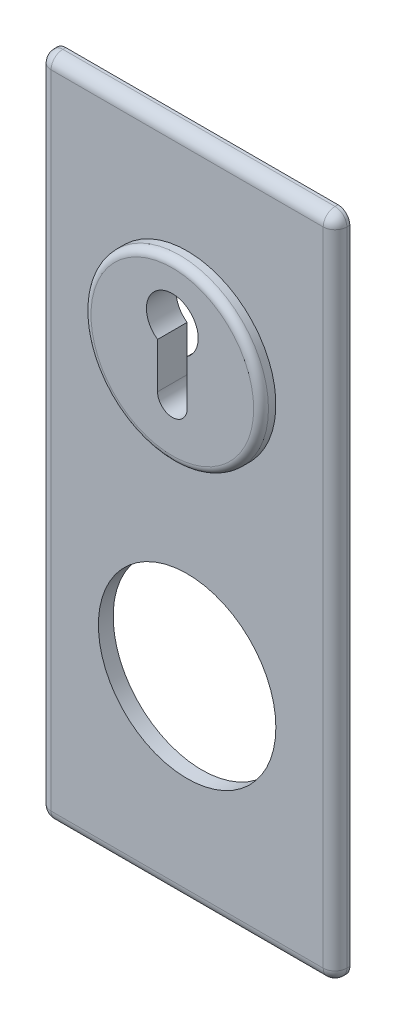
SolidWorks part; units mm, degrees
ref_plane "Front Plane" through (0, 0, 0) normal (0, 0, 1) x (1, 0, 0)
ref_plane "Top Plane" through (0, 0, 0) normal (0, 1, 0) x (1, 0, 0)
ref_plane "Right Plane" through (0, 0, 0) normal (1, 0, 0) x (0, 0, -1)
sketch "Sketch2" plane through (0, 0, 0) normal (0, 0, 1) x (1, 0, 0)
  line L1 (-25.4, -57.15) -> (25.4, -57.15)
  line L2 (-25.4, -57.15) -> (-25.4, 57.15)
  line L3 (-25.4, 57.15) -> (25.4, 57.15)
  line L4 (25.4, -57.15) -> (25.4, 57.15)
  line L5 (-25.4, -57.15) -> (25.4, 57.15) construction
  line L6 (-25.4, 57.15) -> (25.4, -57.15) construction
  point P0 (0, 0)
  dimension "D1" = 114.3
  dimension "D2" = 50.8
extrude "Boss-Extrude1" add sketch "Sketch2" along normal blind 2.54
fillet "Fillet1" radius 2.032 8 edges at (0, -57.15, 2.54) (-25.4, 0, 2.54) (25.4, 0, 2.54) (0, 57.15, 2.54) (25.4, 57.15, 1.27) (-25.4, 57.15, 1.27) (-25.4, -57.15, 1.27) (25.4, -57.15, 1.27)
sketch "Sketch3" plane through (0, 0, 2.54) normal (0, 0, 1) x (1, 0, 0)
  line L0 (-23.368, -55.118) -> (23.368, -55.118) construction
  circle A0 centre (0, -23.368) radius 15.24
  dimension "D2" = 30.48
  dimension "D1" = 31.75
extrude "Cut-Extrude1" cut sketch "Sketch3" against normal through all
sketch "Sketch4" plane through (0, 0, 2.54) normal (0, 0, 1) x (1, 0, 0)
  line L0 (23.368, 55.118) -> (-23.368, 55.118) construction
  circle A0 centre (0, 24.638) radius 15.24
  dimension "D2" = 30.48
  dimension "D1" = 30.48
extrude "Boss-Extrude2" add sketch "Sketch4" along normal blind 2.54
fillet "Fillet2" radius 1.27 1 edges at (15.24, 24.638, 5.08)
sketch "Sketch5" plane through (0, 0, 5.08) normal (0, 0, 1) x (1, 0, 0)
  point P0 (0, 24.638)
sketch "Sketch21" plane through (0.4187, 23.6587, 5.08) normal (0, 0, 1) x (1, 0, 0)
  line L0 (-0.4187, 6.6943) -> (-0.4187, -4.7357) construction
  line L1 (2.1213, 6.6943) -> (2.1213, -4.7357)
  line L2 (-2.9587, 6.6943) -> (-2.9587, -4.7357)
  arc A0 (2.1213, 6.6943) -> (-2.9587, 6.6943) centre (-0.4187, 6.6943) ccw
  arc A1 (-2.9587, -4.7357) -> (2.1213, -4.7357) centre (-0.4187, -4.7357) ccw
  circle A2 centre (-0.4187, 6.6943) radius 4.445
  circle A3 centre (-0.4187, 0.9793) radius 13.97 construction
  point P3 (-0.4187, 0.9793)
  dimension "D3" = 8.89
  dimension "D1" = 11.43
  dimension "D2" = 5.08
extrude "Cut-Extrude11" cut sketch "Sketch21" against normal blind 25.4
other "Filleted Keyway<1>"
